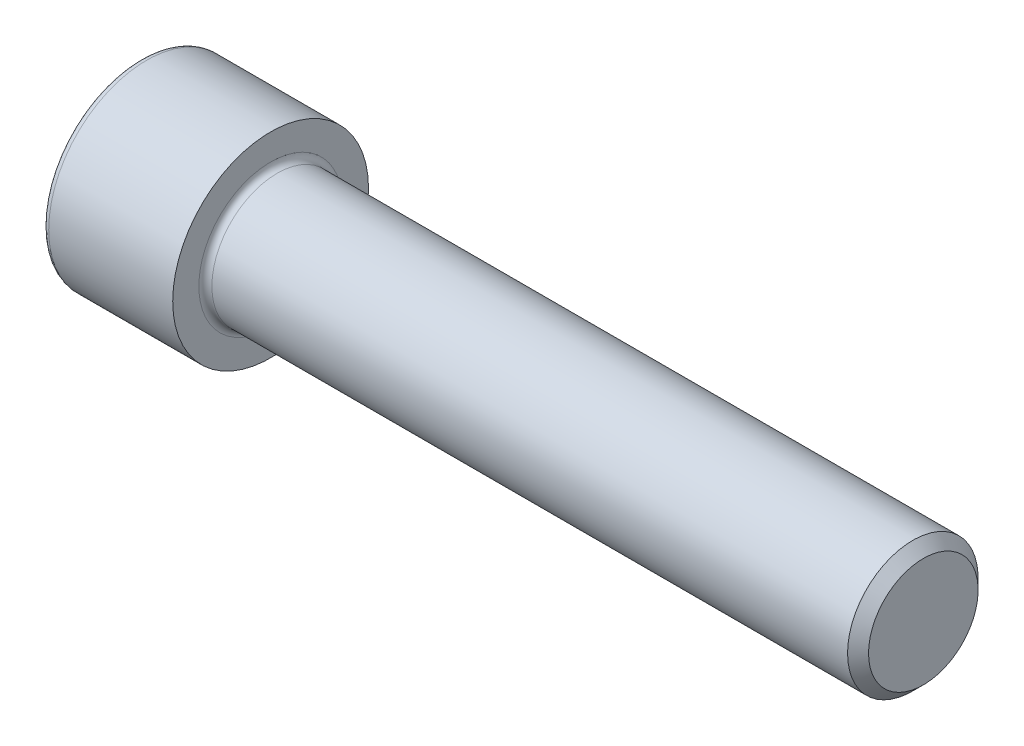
SolidWorks part; units mm, degrees
ref_plane "Plane1" through (0, 0, 0) normal (0, 0, 1) x (1, 0, 0)
ref_plane "Plane2" through (0, 0, 0) normal (0, 1, 0) x (1, 0, 0)
ref_plane "Plane3" through (0, 0, 0) normal (1, 0, 0) x (0, 0, -1)
sketch "BodySke" plane through (0, 0, 0) normal (0, 0, 1) x (1, 0, 0)
  line L0 (0, 0) -> (0, 9)
  line L1 (0, 9) -> (12, 9)
  line L2 (12, 9) -> (12, 6)
  line L3 (12, 6) -> (71.036, 6)
  line L4 (72, 5.036) -> (72, 0)
  line L5 (72, 0) -> (0, 0)
  line L6 (-31.75, 0) -> (127, 0) construction
  line L8 (72, 5.036) -> (71.036, 6)
  line L10 (72, -5.036) -> (71.036, -6) construction
  line L11 (13.75, 9.525) -> (13.75, 3.175) construction
  line L12 (36, 9.525) -> (36, 3.175) construction
  line L13 (12, 9.525) -> (12, 3.175) construction
  dimension "Diameter" = 12
  dimension "Head_ht" = 12
  dimension "Length" = 60
  dimension "Body_ch_ang" = 45
  dimension "Head_dia" = 18
  dimension "Minor_dia" = 10.072
  dimension "Advance" = 1.75
  dimension "Thread_nom" = 36
  dimension "Thread_length" = 60
revolve "Base-Revolve" add sketch "BodySke"
fillet "Fillet1" radius 0.6 1 edges at (12, 0, 6)
fillet "Fillet2" radius 0.6 1 edges at (0, 0, 9)
sketch "Sketch2" plane through (0, 0, 0) normal (0, 0, 1) x (1, 0, 0)
  line L0 (0, 5.0575) -> (6, 5.0575)
  line L1 (6, 5.0575) -> (8.9199, 0)
  line L2 (-31.75, 0) -> (127, 0) construction
  line L3 (8.9199, 0) -> (0, 0)
  line L4 (0, 0) -> (0, 5.0575)
  line L6 (0, 0) -> (47.625, 0) construction
  dimension "D1" = 5.0575
  dimension "D2" = 60
  dimension "Depth" = 6
revolve "Hex-PreBroach" cut sketch "Sketch2" angle 360 about L6
sketch "Sketch3" plane through (0, 0, 0) normal (-1, 0, 0) x (0, 0.5, 0.866)
  line L0 (2.9199, 5.0575) -> (-2.9199, 5.0575)
  line L1 (-2.9199, 5.0575) -> (-5.8399, 0)
  line L2 (2.9199, 5.0575) -> (5.8399, 0)
  line L3 (2.9199, -5.0575) -> (5.8399, 0)
  line L4 (2.9199, -5.0575) -> (-2.9199, -5.0575)
  line L5 (-2.9199, -5.0575) -> (-5.8399, 0)
  dimension "D1" = 5.0575
  dimension "D2" = 5.0575
  dimension "Hex_size" = 10.115
extrude "Hex" cut sketch "Sketch3" against normal blind 6
sketch "ThdSchSke" plane through (0, 0, 0) normal (0, 0, 1) x (1, 0, 0)
  line L0 (36, -5.036) -> (35.325, -6)
  line L1 (36, -5.036) -> (36.675, -6)
  line L2 (36.675, -6) -> (36.675, -7.5)
  line L3 (-3.175, 0) -> (5.1513, 0) construction
  line L4 (0, 8.4) -> (0, -8.4) construction
  line L5 (36.675, -7.5) -> (35.325, -7.5)
  line L6 (35.325, -7.5) -> (35.325, -6)
  dimension "Thread_minor" = 10.072
  dimension "Diameter" = 12
  dimension "Start" = 36
  dimension "SideAngle" = 55
  dimension "VeeAngle" = 70
  dimension "Overcut" = 15
revolve "ThreadSchematic" [suppressed] cut sketch "ThdSchSke" angle 360 about L3
pattern_linear "ThdSchPat" [suppressed]
equation "\"D2@Sketch3\" = \"Hex_size@Sketch3\" / 2"
equation "\"D1@Sketch3\" = \"Hex_size@Sketch3\" / 2"
equation "\"D1@Sketch2\" = \"Hex_size@Sketch3\" / 2"
equation "\"Thread_minor@ThreadCosmetic\"  =  \"Minor_dia@BodySke\""
equation "\"Depth@Sketch2\" =  \"Key_eng@Hex\""
equation "\"Thread_length@ThreadCosmetic\" = ((sgn( (\"Length@BodySke\" - \"Advance@BodySke\" * 3.0) - \"Thread_nom@BodySke\" )-1)*( (\"Length@BodySke\" - \"Advance@BodySke\" * 3.0) - \"Thread_nom@BodySke\" ))/-2+ \"Thread_no"
equation "\"Thread_minor@ThdSchSke\" = \"Minor_dia@BodySke\""
equation "\"Diameter@ThdSchSke\" = \"Diameter@BodySke\""
equation "\"Overcut@ThdSchSke\" = \"Diameter@BodySke\" * 1.25"
equation "\"Start@ThdSchSke\" = \"Head_ht@BodySke\" + \"Length@BodySke\" - \"Thread_length@ThreadCosmetic\"  '---Non-countersunk---"
equation "\"Num_threads@ThdSchPat\" = int( \"Thread_length@ThreadCosmetic\" / \"Advance@BodySke\" + 0.999 )  + 1"
equation "\"Advance@ThdSchPat\" = \"Thread_length@ThreadCosmetic\" /  (\"Num_threads@ThdSchPat\" - 1) 'relax it"
equation "\"Num_threads@ThdSchPat\" = \"Num_threads@ThdSchPat\" - sgn( \"Num_threads@ThdSchPat\" - 1) '---chamfered tips only---"
